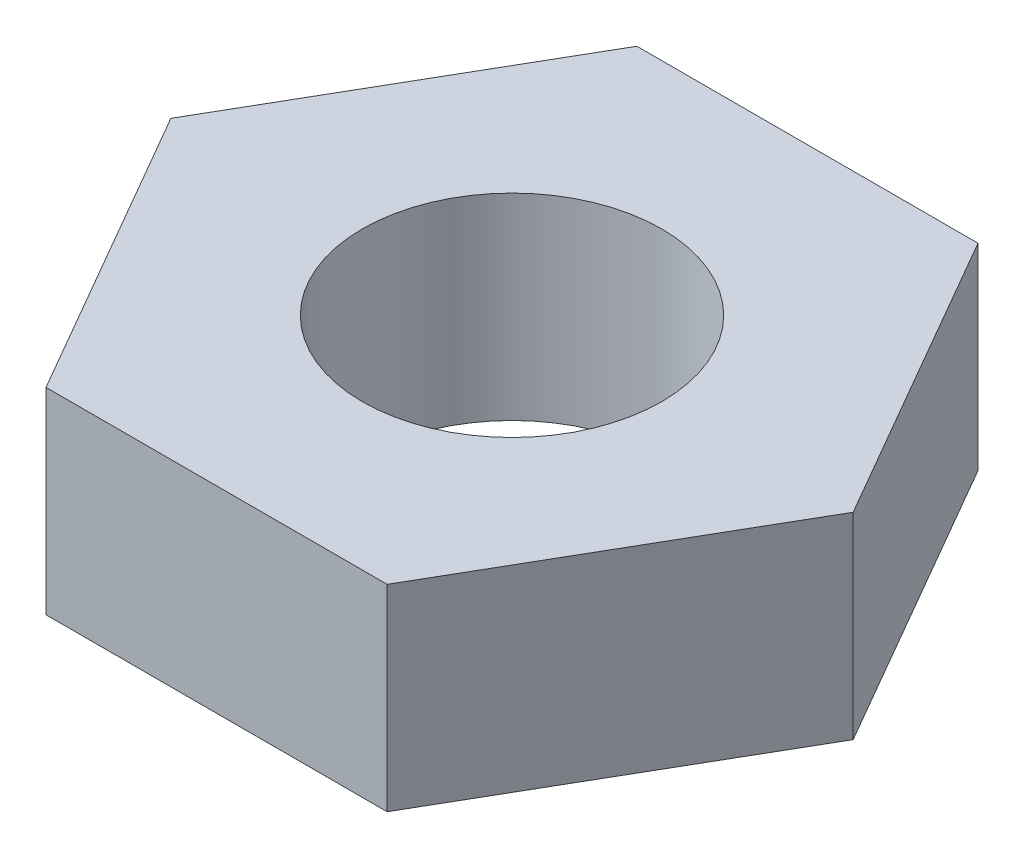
SolidWorks part; units mm, degrees
ref_plane "Front Plane" through (0, 0, 0) normal (0, 0, 1) x (1, 0, 0)
ref_plane "Top Plane" through (0, 0, 0) normal (0, 1, 0) x (1, 0, 0)
ref_plane "Right Plane" through (0, 0, 0) normal (1, 0, 0) x (0, 0, -1)
sketch "Sketch1" plane through (0, 0, 0) normal (0, 1, 0) x (1, 0, 0)
  line L1 (5.4993, 0) -> (2.7496, 4.7625)
  line L2 (2.7496, 4.7625) -> (-2.7496, 4.7625)
  line L3 (-2.7496, 4.7625) -> (-5.4993, 0)
  line L4 (-5.4993, 0) -> (-2.7496, -4.7625)
  line L5 (-2.7496, -4.7625) -> (2.7496, -4.7625)
  line L6 (2.7496, -4.7625) -> (5.4993, 0)
  circle A0 centre (0, 0) radius 2.413
  circle A1 centre (0, 0) radius 4.7625 construction
  dimension "D1" = 4.826
  dimension "D2" = 9.525
extrude "Boss-Extrude1" add sketch "Sketch1" along normal mid plane 3.175
